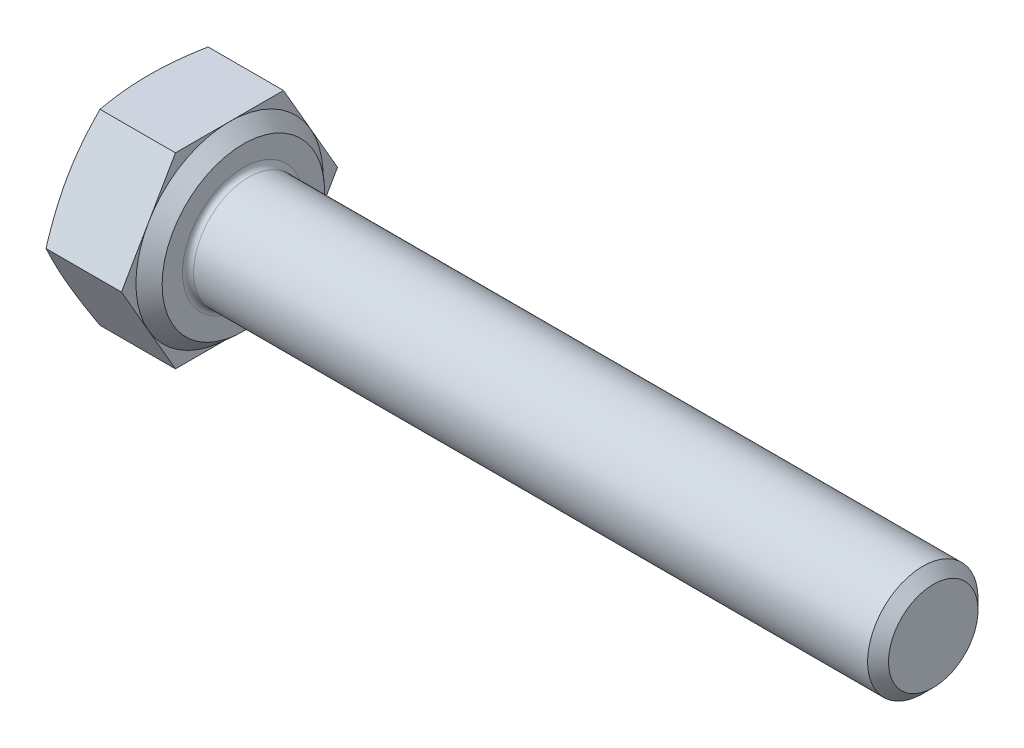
SolidWorks part; units mm, degrees
ref_plane "Front" through (0, 0, 0) normal (0, 0, 1) x (1, 0, 0)
ref_plane "Top" through (0, 0, 0) normal (0, 1, 0) x (1, 0, 0)
ref_plane "Right" through (0, 0, 0) normal (1, 0, 0) x (0, 0, -1)
sketch "Sketch-BaseHead" plane through (0, 0, 0) normal (1, 0, 0) x (0, 0, -1)
  line L1 (3.9144, 0) -> (1.9572, 3.39)
  line L2 (1.9572, 3.39) -> (-1.9572, 3.39)
  line L3 (-1.9572, 3.39) -> (-3.9144, 0)
  line L4 (-3.9144, 0) -> (-1.9572, -3.39)
  line L5 (-1.9572, -3.39) -> (1.9572, -3.39)
  line L6 (1.9572, -3.39) -> (3.9144, 0)
  circle A0 centre (0, 0) radius 3.39 construction
  dimension "s" = 6.78
extrude "BaseHead" add sketch "Sketch-BaseHead" along normal blind 2.925
sketch "Sketch4" plane through (-0.2646, 0, 5.9169) normal (0, 1, 0) x (0, 0, -1)
  line L0 (5.9169, 3.7369) -> (5.9169, -10.4477) construction
  line L2 (9.8313, -0.2646) -> (9.3069, -0.2646)
  line L4 (9.3069, -0.2646) -> (9.8313, -0.4555)
  line L6 (9.8313, -0.4555) -> (9.8313, -0.2646)
  dimension "D1" = 20
  dimension "D2" = 6.78
revolve "HeadChamfer" cut sketch "Sketch4" angle 360 about L0
sketch "Sketch1" plane through (0, 0, 0) normal (0, 0, 1) x (1, 0, 0)
  line L0 (2.925, 0) -> (3.425, 0)
  line L1 (3.425, 0) -> (3.425, -2.94)
  line L2 (3.425, -2.94) -> (2.925, -3.39)
  line L3 (2.925, -3.39) -> (2.925, 0) construction
  line L4 (0, 0) -> (7.5821, 0) construction
  line L5 (-4.0016, 0) -> (10.1831, 0) construction
  line L6 (2.925, -3.39) -> (0.1909, -3.39) construction
  line L7 (2.925, 0) -> (2.925, -3.39)
  dimension "D1" = 3.39
  dimension "c" = 0.5
  dimension "D2" = 2.94
revolve "Revolve1" add sketch "Sketch1" angle 360 about axis through (-4.0016, 0, 0) along (1, 0, 0)
ref_plane "Plane2" through (14.425, 0, 0) normal (1, 0, 0) x (0, 0, -1)
sketch "Sketch3" plane through (3.425, 0, 0) normal (1, 0, 0) x (0, 0, -1)
  circle A0 centre (0, 0) radius 2
  dimension "d" = 4
extrude "BaseBody" add sketch "Sketch3" along normal blind 25
fillet "HeadFillet" radius 0.2 1 edges at (3.425, 0, -2)
chamfer "Chamfer1" distance 0.379 angle 45 1 edges at (28.425, 0, -2)
equation "\"D1@Sketch1\" = \"s@Sketch-BaseHead\"/ 2"
equation "\"D2@Sketch4\" = \"s@Sketch-BaseHead\""
equation "\"D1@Chamfer1\" =  ( \"d@Sketch3\" - \"D2@ThreadCosmetic1\" ) / 2 "
equation "\"b@ThreadCosmetic1\" = \"l@BaseBody\" - \"lg@Plane2\""
